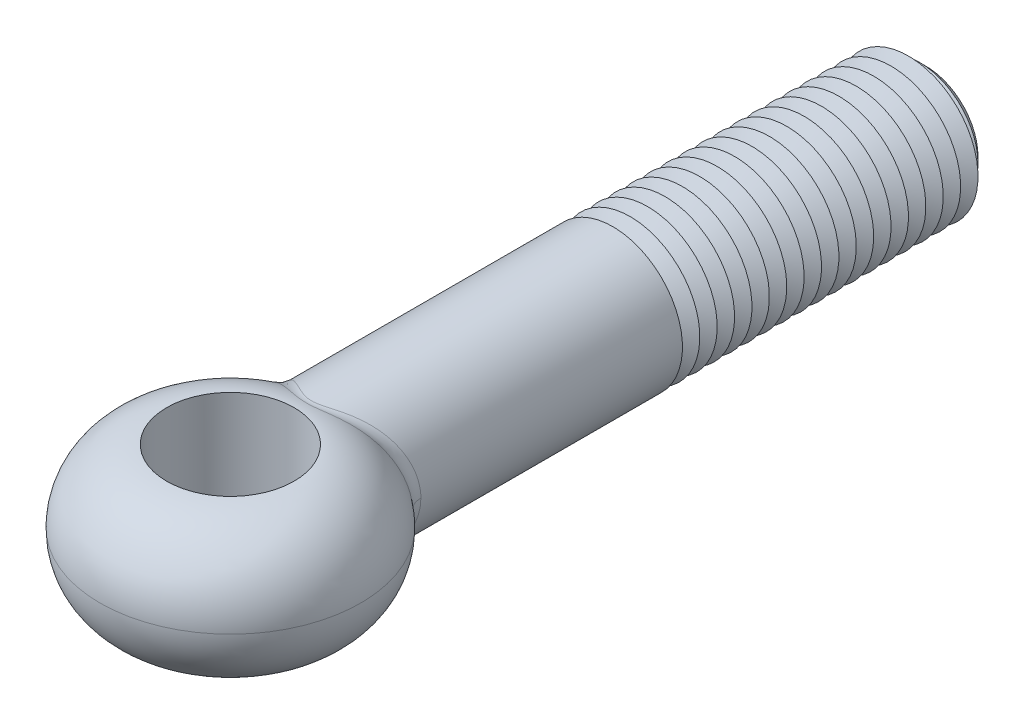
SolidWorks part; units mm, degrees
ref_plane "Front Plane" through (0, 0, 0) normal (0, 0, 1) x (1, 0, 0)
ref_plane "Top Plane" through (0, 0, 0) normal (0, 1, 0) x (1, 0, 0)
ref_plane "Right Plane" through (0, 0, 0) normal (1, 0, 0) x (0, 0, -1)
sketch "Sketch7" plane through (0, 0, 0) normal (0, 1, 0) x (1, 0, 0)
  circle A0 centre (0, 0) radius 22.5
  dimension "D1" = 45
extrude "Boss-Extrude3" add sketch "Sketch7" along normal mid plane 25
sketch "Sketch8" plane through (0, 0, 0) normal (0, 0, 1) x (1, 0, 0)
  circle A0 centre (0, 0) radius 12
  dimension "D1" = 24
extrude "Boss-Extrude4" add sketch "Sketch8" against normal blind 120
fillet "Fillet5" radius 12.5 2 edges at (0, -12.5, 22.5) (0, 12.5, 22.5)
fillet "Fillet6" radius 3.5 2 edges at (0.1915, -11.9985, -13.5039) (-0.1915, 11.9985, -13.5039)
chamfer "Chamfer1" distance 3 angle 45 1 edges at (12, 0, -120)
sketch "Sketch10" plane through (0, 0, 0) normal (0, 1, 0) x (1, 0, 0)
  line L0 (0, 28.1405) -> (0, -7.9233) construction
sketch "Sketch11" plane through (0, 0, 0) normal (0, 1, 0) x (1, 0, 0)
  line L0 (-12, 66) -> (-9.4019, 67.5)
  line L1 (-12, 117) -> (-12, 20.8746) construction
  line L2 (-9.4019, 67.5) -> (-12, 69)
  line L3 (-12, 69) -> (-12, 66)
  line L4 (9, 120) -> (-9, 120) construction
  dimension "D1" = 3
  dimension "D2" = 54
revolve "Cut-Revolve1" cut sketch "Sketch11" angle 360 about L0
pattern_linear "LPattern1" count 18 spacing 3 along (0, 0, -1) of "Cut-Revolve1"
sketch "Sketch12" plane through (0, 0, 0) normal (0, 1, 0) x (1, 0, 0)
  circle A0 centre (0, 0) radius 11
  dimension "D1" = 22
extrude "Cut-Extrude1" cut sketch "Sketch12" against normal mid plane 25
